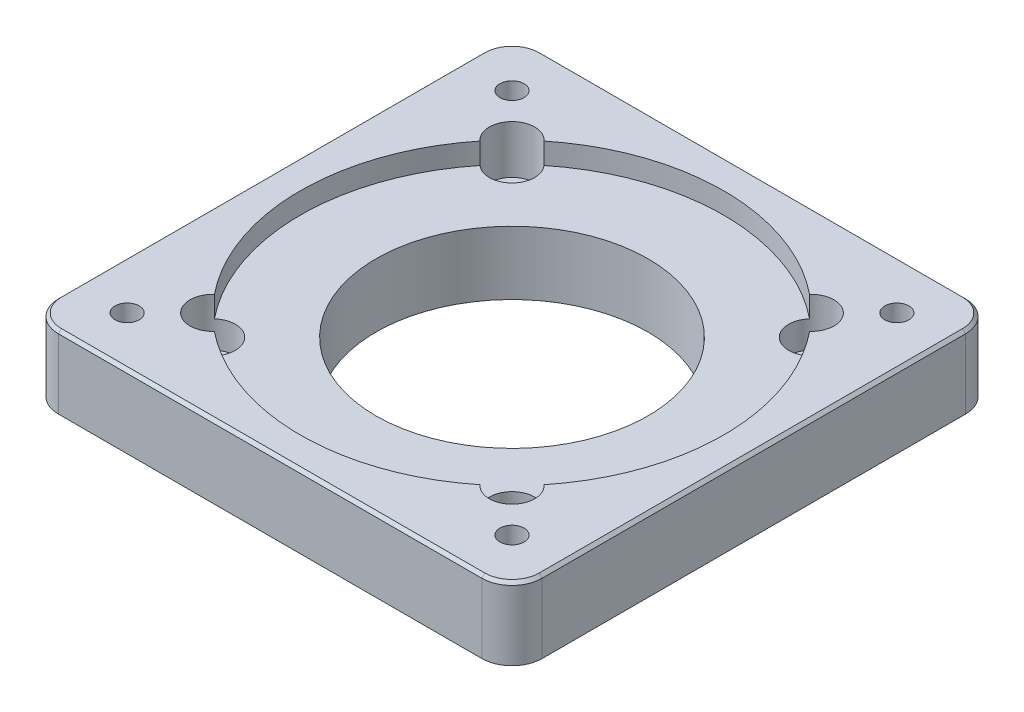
SolidWorks part; units mm, degrees
ref_plane "前视基准面" through (0, 0, 0) normal (0, 0, 1) x (1, 0, 0)
ref_plane "上视基准面" through (0, 0, 0) normal (0, 1, 0) x (1, 0, 0)
ref_plane "右视基准面" through (0, 0, 0) normal (1, 0, 0) x (0, 0, -1)
sketch "草图1" plane through (0, 0, 0) normal (0, 1, 0) x (1, 0, 0)
  line L0 (0, -98.2358) -> (0, 74.1567) construction
  line L1 (88.1156, 0) -> (-86.7197, 0) construction
  line L3 (-40, 40) -> (40, 40)
  line L4 (-40, 40) -> (-40, -40)
  line L5 (-40, -40) -> (40, -40)
  line L6 (40, 40) -> (40, -40)
  dimension "D1" = 80
  dimension "D2" = 80
extrude "凸台-拉伸1" add sketch "草图1" along normal blind 12
sketch "草图2" plane through (0, 12, 0) normal (0, 1, 0) x (1, 0, 0)
  circle A0 centre (0, 0) radius 35
  dimension "D1" = 70
extrude "切除-拉伸1" cut sketch "草图2" against normal blind 3.5
sketch "草图3" plane through (0, 8.5, 0) normal (0, 1, 0) x (1, 0, 0)
  circle A0 centre (0, 0) radius 9
  dimension "D1" = 18
extrude "切除-拉伸2" cut sketch "草图3" against normal blind 18
sketch "草图5" plane through (0, 0, 0) normal (0, -1, 0) x (1, 0, 0)
  circle A0 centre (0, 0) radius 22.5
  dimension "D1" = 45
extrude "切除-拉伸3" cut sketch "草图5" against normal blind 48
sketch "草图6" plane through (0, 12, 0) normal (0, 1, 0) x (1, 0, 0)
  line L0 (0, -91.1119) -> (0, 79.7492) construction
  line L1 (90.6911, 0) -> (-87.7452, 0) construction
  line L3 (-35, 35) -> (35, 35) construction
  line L4 (-35, 35) -> (-35, -35) construction
  line L5 (-35, -35) -> (35, -35) construction
  line L6 (35, 35) -> (35, -35) construction
  dimension "D1" = 70
  dimension "D2" = 70
sketch "草图9" plane through (0, 12, 0) normal (0, 1, 0) x (1, 0, 0)
  line L0 (0, -97.3193) -> (0, 99.0728) construction
  line L1 (108.5417, 0) -> (-83.9927, 0) construction
  line L2 (0, 0) -> (24.7487, 24.7487) construction
  circle A2 centre (0, 0) radius 35 construction
  circle A4 centre (24.7487, 24.7487) radius 3.75
  dimension "D1" = 45
  dimension "D2" = 70
  dimension "D3" = 7.5
extrude "切除-拉伸4" cut sketch "草图9" against normal blind 8
sketch "草图15" plane through (0, 4, 0) normal (0, 1, 0) x (1, 0, 0)
  circle A0 centre (24.7487, 24.7487) radius 2.25
  dimension "D1" = 4.5
extrude "切除-拉伸10" cut sketch "草图15" against normal blind 12
pattern_circular "阵列(圆周)1" count 4 over 360 about axis through (0, 0, 0) along (0, 1, 0) of "切除-拉伸10", "切除-拉伸4"
fillet "圆角1" radius 5 4 edges at (40, 6, 40) (40, 6, -40) (-40, 6, -40) (-40, 6, 40)
sketch "草图16" plane through (0, 12, 0) normal (0, 1, 0) x (1, 0, 0)
  line L1 (31.8198, -31.8198) -> (-31.8198, -31.8198) construction
  line L2 (31.8198, -31.8198) -> (31.8198, 31.8198) construction
  line L3 (31.8198, 31.8198) -> (-31.8198, 31.8198) construction
  line L4 (-31.8198, -31.8198) -> (-31.8198, 31.8198) construction
  line L5 (31.8198, -31.8198) -> (-31.8198, 31.8198) construction
  line L6 (31.8198, 31.8198) -> (-31.8198, -31.8198) construction
  circle A0 centre (0, 0) radius 45 construction
  circle A1 centre (-31.8198, 31.8198) radius 2
  circle A2 centre (31.8198, 31.8198) radius 2
  circle A3 centre (31.8198, -31.8198) radius 2
  circle A4 centre (-31.8198, -31.8198) radius 2
  dimension "D2" = 90
  dimension "D3" = 4
  dimension "D1" = 90
extrude "切除-拉伸11" cut sketch "草图16" against normal through all
sketch "草图17" plane through (0, 0, 0) normal (0, -1, 0) x (1, 0, 0)
  circle A0 centre (0, 0) radius 22.5
  circle A1 centre (0, 0) radius 22.5 construction
extrude "拉伸-薄壁1" add sketch "草图17" along normal blind 2 thin
chamfer "倒角1" distance 0.5 angle 45 8 edges at (0, 12, -40) (-38.5355, 12, -38.5355) (38.5355, 12, -38.5355) (-40, 12, 0) (40, 12, 0) (-38.5355, 12, 38.5355) (38.5355, 12, 38.5355) (0, 12, 40)
